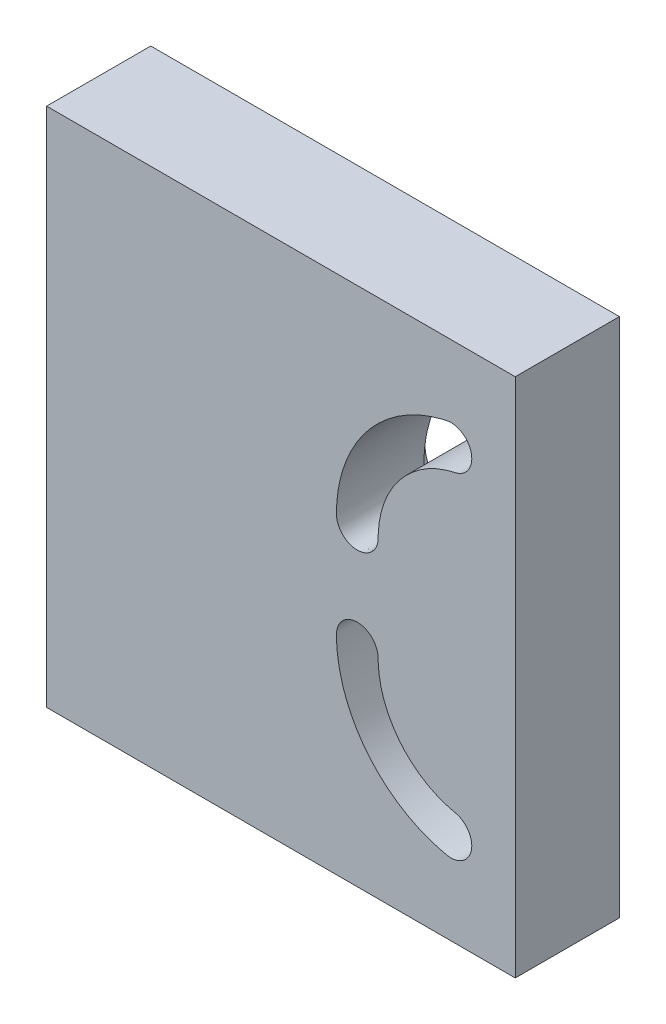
SolidWorks part; units mm, degrees
ref_plane "Płaszczyzna przednia" through (0, 0, 0) normal (0, 0, 1) x (1, 0, 0)
ref_plane "Płaszczyzna górna" through (0, 0, 0) normal (0, 1, 0) x (1, 0, 0)
ref_plane "Płaszczyzna prawa" through (0, 0, 0) normal (1, 0, 0) x (0, 0, -1)
sketch "Szkic1" plane through (0, 0, 0) normal (0, 0, 1) x (1, 0, 0)
  line L1 (-45, 50) -> (45, 50)
  line L2 (-45, 50) -> (-45, 0)
  line L3 (-45, 0) -> (45, 0)
  line L4 (45, 50) -> (45, 0)
  dimension "D1" = 90
  dimension "D2" = 50
extrude "Dodanie-wyciągnięcie1" add sketch "Szkic1" along normal blind 20 contours L1 L4 L3 L2
sketch "Szkic2" plane through (0, 0, 20) normal (0, 0, 1) x (1, 0, 0)
  line L0 (37.3696, 10) -> (33.4816, 28.2914)
  line L1 (37.3696, 10) -> (18.6696, 10)
  circle A0 centre (37.3696, 10) radius 3.2114
  arc A1 (33.4816, 28.2914) -> (31.8183, 36.1165) centre (32.65, 32.204) ccw construction
  arc A3 (10.6696, 10) -> (18.6696, 10) centre (14.6696, 10) ccw construction
  arc A4 (33.4816, 28.2914) -> (18.6696, 10) centre (37.3696, 10) ccw construction
  arc A5 (31.8183, 36.1165) -> (10.6696, 10) centre (37.3696, 10) ccw construction
  spline S0 degree 3 poles (33.4696, 28.2888) (24.4679, 26.3693) (18.6756, 19.2164) (18.6696, 10.0123) (18.6696, 10.0095) (18.6696, 10.004) (18.6696, 9.9957) (18.6696, 9.9902) (18.6696, 9.9875) (18.6446, 2.033) (10.6901, 2.0352) (10.6696, 9.9897) (10.6696, 9.992) (10.6696, 9.9965) (10.6696, 10.0033) (10.6696, 10.0078) (10.6696, 10.0101) (10.6745, 23.1581) (18.9488, 33.376) (31.8085, 36.1144) (31.8107, 36.1149) (31.8151, 36.1159) (31.8218, 36.1173) (31.8262, 36.1182) (31.8284, 36.1187) (39.6133, 37.7525) (41.2694, 29.9722) (33.4939, 28.294) (33.4912, 28.2934) (33.4858, 28.2922) (33.4777, 28.2905) (33.4723, 28.2894) (33.4696, 28.2888) (24.4679, 26.3693) (18.6756, 19.2164) knots -0.000113 0 0 0 0.321286 0.321286 0.321286 0.321399 0.321513 0.321626 0.321626 0.321626 0.430918 0.430918 0.430918 0.431011 0.431104 0.431196 0.431196 0.431196 0.89009 0.89009 0.89009 0.890183 0.890276 0.890368 0.890368 0.890368 0.999661 0.999661 0.999661 0.999774 0.999887 1 1 1 1.321286 1.321286 1.321286 weights 1 0.851706 0.851706 1 1 1 1 1 1 0.335237 0.335237 1 1 1 1 1 1 0.851589 0.851589 1 1 1 1 1 1 0.335237 0.335237 1 1 1 1 1 1 0.851706 0.851706 only from (33.4696, 28.2888) to (33.4696, 28.2888)
  dimension "D1" = 8
  dimension "D2" = 8
  dimension "D3" = 22.7
  dimension "D4" = 78
extrude "Wytnij-wyciągnięcie1" cut sketch "Szkic2" against normal through all contours S0
sketch "Szkic6" plane through (0, 0, 0) normal (0, 0, -1) x (-1, 0, 0)
  spline S2 degree 3 number of poles 138 (-7.6696, 10.0112) -> (-7.6696, 10.0112)
  spline S3 degree 3 number of poles 138 (-7.6696, 10.0112) -> (-7.6696, 10.0112)
  dimension "D1" = 3
extrude "Wytnij-wyciągnięcie2" cut sketch "Szkic6" against normal blind 3.2
mirror "Lustro1" about plane through (-45, 0, 20) normal (0, 1, 0)
